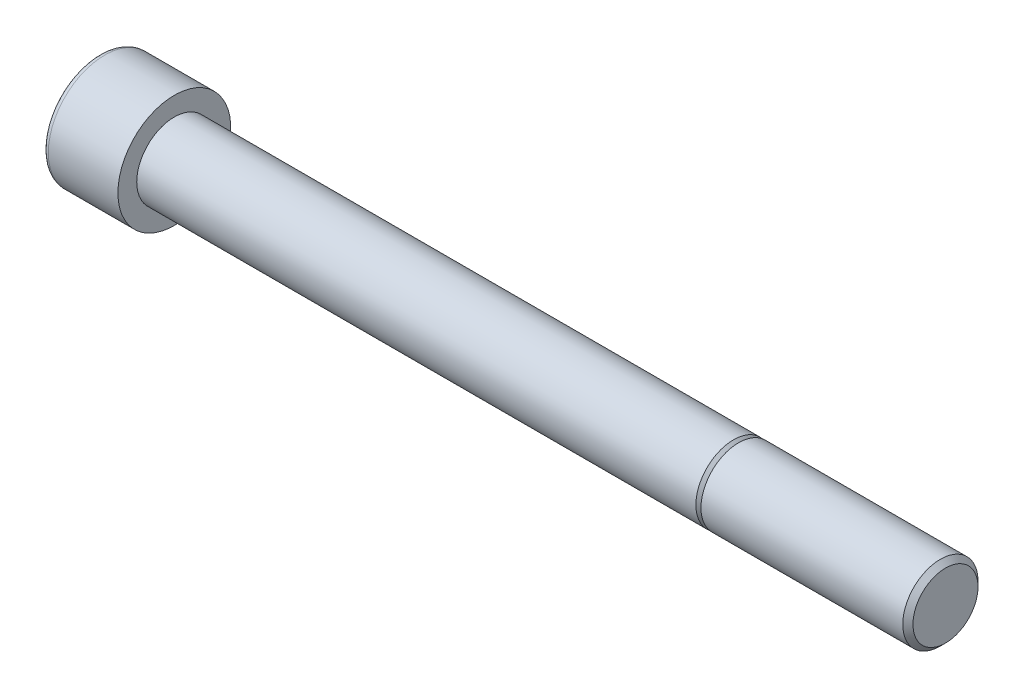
SolidWorks part; units mm, degrees
ref_plane "Plan de face" through (0, 0, 0) normal (0, 0, 1) x (1, 0, 0)
ref_plane "Plan de dessus" through (0, 0, 0) normal (0, 1, 0) x (1, 0, 0)
ref_plane "Plan de droite" through (0, 0, 0) normal (1, 0, 0) x (0, 0, -1)
ref_plane "Plan1" through (0, 0, 0) normal (0, 0, -1) x (-1, 0, 0)
sketch "Esquisse1" plane through (0, 0, 0) normal (0, 0, -1) x (-1, 0, 0)
  line L0 (-80, 8) -> (-80, 0)
  line L1 (-80, 0) -> (100, 0)
  line L2 (100, 0) -> (100, 12)
  line L3 (100, 12) -> (84, 12)
  line L4 (84, 12) -> (84, 8)
  line L5 (84, 8) -> (-34.9175, 8)
  line L6 (-34.9175, 8) -> (-36, 6.9175)
  line L7 (-36, 6.9175) -> (-36, 8)
  line L8 (-36, 8) -> (-80, 8)
  line L9 (-80, 0) -> (100, 0) construction
  dimension "D1" = 16
  dimension "D2" = 44
  dimension "D3" = 135
  dimension "D4" = 180
revolve "Révolution1" add sketch "Esquisse1" angle 360 about L9
sketch "Esquisse2" plane through (-100, 0, 0) normal (-1, 0, 0) x (0, 0, 1)
  line L0 (-7, -4.0415) -> (0, -8.0829)
  line L1 (0, -8.0829) -> (7, -4.0415)
  line L2 (7, -4.0415) -> (7, 4.0415)
  line L3 (7, 4.0415) -> (0, 8.0829)
  line L4 (0, 8.0829) -> (-7, 4.0415)
  line L5 (-7, 4.0415) -> (-7, -4.0415)
extrude "Enlèv. mat.-Extru.1" cut sketch "Esquisse2" against normal blind 8
chamfer "Chanfrein1" distance 1.0825 angle 45 1 edges at (80, 0, 8)
fillet "Congé1" radius 1.2 1 edges at (-100, 0, 12)
